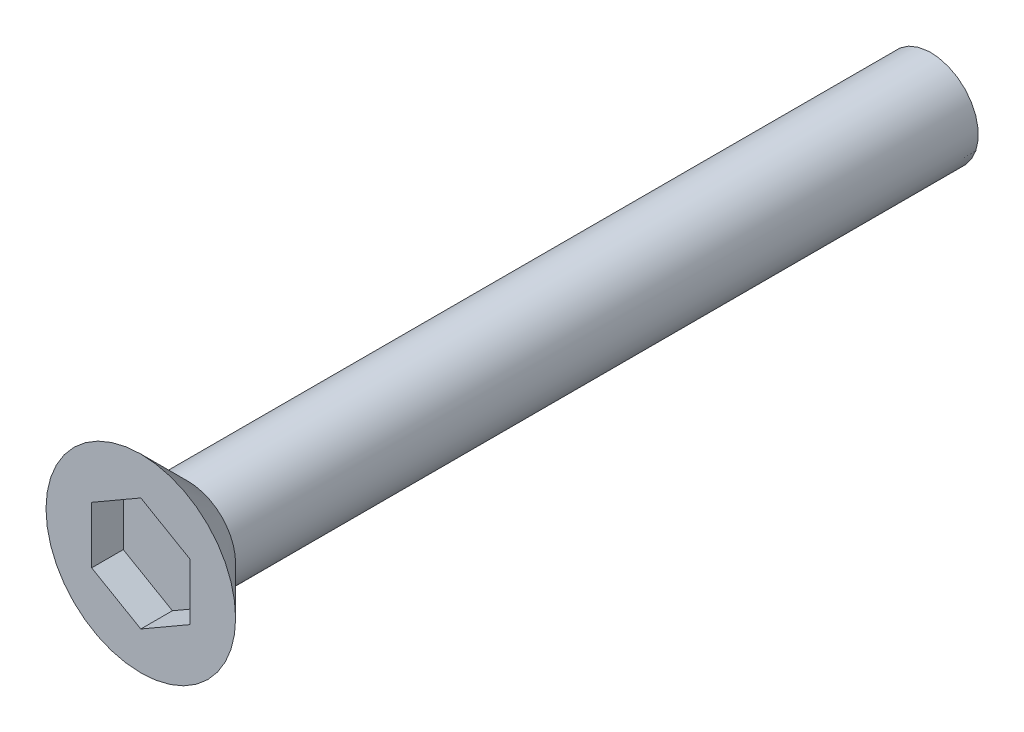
SolidWorks part; units mm, degrees
ref_plane "Front Plane" through (0, 0, 0) normal (0, 0, 1) x (1, 0, 0)
ref_plane "Top Plane" through (0, 0, 0) normal (0, 1, 0) x (1, 0, 0)
ref_plane "Right Plane" through (0, 0, 0) normal (1, 0, 0) x (0, 0, -1)
imported_body "Bolt_m3_30mm.stp<1>"
sketch "Sketch1" plane through (0, 0, 0) normal (1, 0, 0) x (0, 0, -1)
  line L0 (-1.75, 1.5) -> (-30.25, 1.5) construction
  line L1 (-30.25, -1.5) -> (-1.75, -1.5) construction
  line L2 (-1.75, -1.5) -> (-1.75, 1.5) construction
  line L3 (-1.75, 1.5) -> (-6.75, 1.5)
  line L4 (-6.75, -1.5) -> (-1.75, -1.5)
  line L5 (-1.75, -1.5) -> (-1.75, 1.5)
  line L6 (-6.75, -1.5) -> (-6.75, 1.5)
  dimension "D1" = 5
extrude "Cut-Extrude1" cut sketch "Sketch1" along normal through all both and the other way through all
